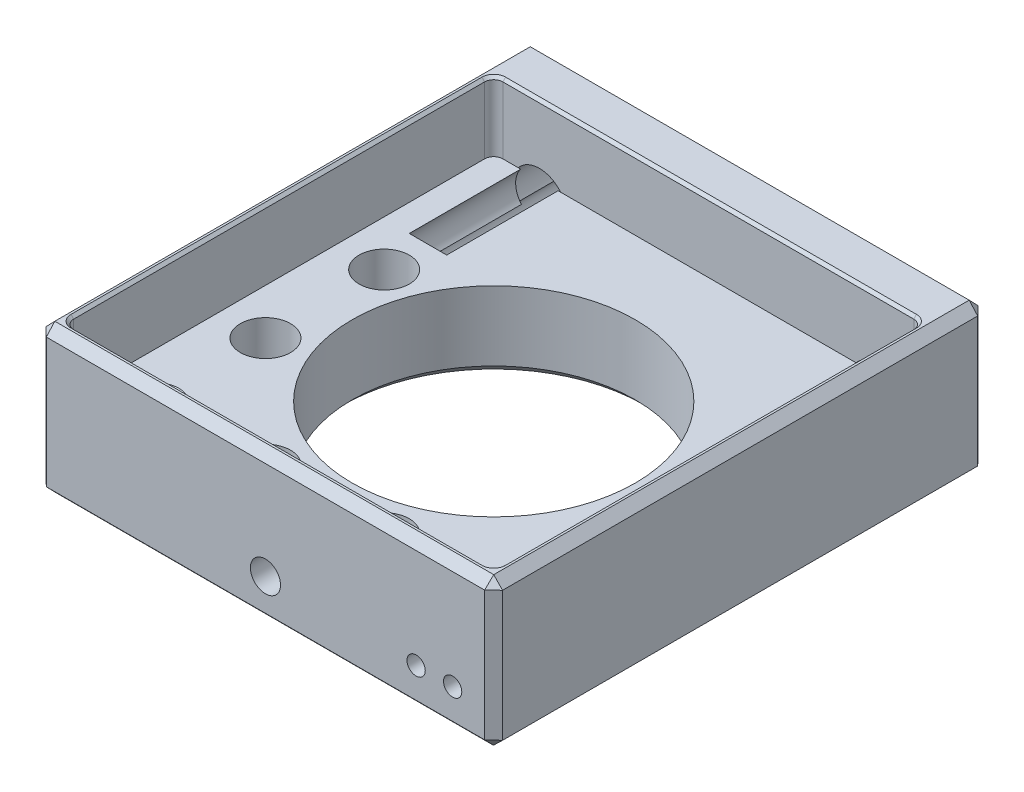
SolidWorks part; units mm, degrees
ref_plane "前视基准面" through (0, 0, 0) normal (0, 0, 1) x (1, 0, 0)
ref_plane "上视基准面" through (0, 0, 0) normal (0, 1, 0) x (1, 0, 0)
ref_plane "右视基准面" through (0, 0, 0) normal (1, 0, 0) x (0, 0, -1)
other "Configuration Table"
sketch "草图1" plane through (0, 0, 0) normal (0, 1, 0) x (1, 0, 0)
  line L1 (-25, 27) -> (25, 27)
  line L2 (-25, 27) -> (-25, -27)
  line L3 (-25, -27) -> (25, -27)
  line L4 (25, 27) -> (25, -27)
  line L5 (-25, 27) -> (25, -27) construction
  line L6 (-25, -27) -> (25, 27) construction
  point P0 (0, 0)
  dimension "D1" = 50
  dimension "D2" = 54
extrude "凸台-拉伸1" add sketch "草图1" along normal blind 16.2
sketch "草图2" plane through (0, 16.2, 0) normal (0, 1, 0) x (1, 0, 0)
  line L0 (0, 27) -> (0, -29.013) construction
  line L1 (23.5, -25.5) -> (-23.5, -25.5)
  line L2 (23.5, -25.5) -> (23.5, 21.5)
  line L3 (23.5, 21.5) -> (-23.5, 21.5)
  line L4 (-23.5, -25.5) -> (-23.5, 21.5)
  line L5 (23.5, -25.5) -> (-23.5, 21.5) construction
  line L6 (23.5, 21.5) -> (-23.5, -25.5) construction
  line L7 (25, 27) -> (-25, 27) construction
  point P0 (0, -2)
  dimension "D1" = 47
  dimension "D2" = 47
  dimension "D3" = 5.5
extrude "切除-拉伸1" cut sketch "草图2" against normal blind 7.6
sketch "草图3" plane through (0, 8.6, 0) normal (0, 1, 0) x (1, 0, 0)
  line L0 (0, 0) -> (0, -26.514) construction
  line L1 (-25, -27) -> (25, -27) construction
  circle A0 centre (0, -2) radius 15.5
  dimension "D2" = 31
  dimension "D1" = 25
extrude "切除-拉伸2" cut sketch "草图3" against normal up to next
hole_wizard "Ø5.5 (5.5) 直径孔1" positions "草图4" profile "草图5" hole size "Ø5.5" standard "GB"
sketch "草图4" plane through (0, 8.6, 0) normal (0, 1, 0) x (1, 0, 0)
  line L0 (-25, 27) -> (-25, -27) construction
  line L10 (-23.5, -27) -> (23.5, -27) construction
  line L11 (-25, -27) -> (25, -27) construction
  point P0 (-18.5, 4.5)
  point P2 (-18.5, -8.5)
  point P4 (-6.5, -20.5)
  point P26 (6.5, -20.5)
  dimension "D7" = 13
  dimension "D1" = 6.5
  dimension "D2" = 6.5
  dimension "D3" = 18.5
  dimension "D4" = 13
  dimension "D5" = 6.5
  dimension "D6" = 18.5
sketch "草图5" plane through (-18.5, 8.6, -4.5) normal (1, 0, 0) x (0, 0, 1)
  line L0 (0, 0) -> (0, 8.6)
  line L1 (0, 8.6) -> (2.75, 8.6)
  line L2 (2.75, 8.6) -> (2.75, 0)
  line L5 (2.75, 0) -> (0, 0)
  line L11 (0, -6.35) -> (0, 107.95) construction
  dimension "通孔孔直径" = 5.5
  dimension "通孔孔深度" = 8.6
sketch "草图9" plane through (0, 0, 0) normal (0, -1, 0) x (1, 0, 0)
  line L0 (-18.5, 11.25) -> (-18.5, -7.25) construction
  line L3 (-9.25, 20.5) -> (9.25, 20.5) construction
  line L6 (-18.5, 12) -> (-18.5, -8) construction
  line L12 (-17.4, 12) -> (-17.4, -8)
  line L13 (-19.6, 12) -> (-19.6, -8)
  line L14 (-10, 20.5) -> (10, 20.5) construction
  line L15 (-10, 21.6) -> (10, 21.6)
  line L16 (-10, 19.4) -> (10, 19.4)
  circle A20 centre (-18.5, 8.5) radius 2.75 construction
  circle A21 centre (-18.5, -4.5) radius 2.75 construction
  circle A22 centre (-6.5, 20.5) radius 2.75 construction
  circle A23 centre (6.5, 20.5) radius 2.75 construction
  arc A24 (-17.4, 12) -> (-19.6, 12) centre (-18.5, 12) ccw
  arc A25 (-19.6, -8) -> (-17.4, -8) centre (-18.5, -8) ccw
  arc A26 (-10, 21.6) -> (-10, 19.4) centre (-10, 20.5) ccw
  arc A27 (10, 19.4) -> (10, 21.6) centre (10, 20.5) ccw
  point P14 (-18.5, 2)
  point P19 (0, 20.5)
  dimension "D1" = 20
  dimension "D2" = 2.2
  dimension "D3" = 20
  dimension "D4" = 2.2
extrude "切除-拉伸4" cut sketch "草图9" against normal blind 2.6
hole_wizard "M4 螺纹孔1" positions "草图10" profile "草图11" tap size "M4" standard "GB"
sketch "草图10" plane through (-25, 0, 0) normal (-1, 0, 0) x (0, 0, 1)
  line L0 (-27, 0) -> (27, 0) construction
  line L1 (27, 16.2) -> (27, 0) construction
  point P0 (0, 4.5)
  dimension "D1" = 4.5
  dimension "D2" = 27
sketch "草图11" plane through (-25, 4.5, 0) normal (0, 1, 0) x (0, 0, 1)
  line L0 (0, 0) -> (0, 7.9914)
  line L1 (0, 7.9914) -> (1.65, 7)
  line L2 (1.65, 7) -> (1.65, 0)
  line L5 (1.65, 0) -> (0, 0)
  line L10 (0, 7.9914) -> (-1.65, 7) construction
  line L11 (0, -6.35) -> (0, 107.95) construction
  dimension "螺纹孔钻头直径" = 3.3
  dimension "螺纹孔钻头深度" = 7
  dimension "导头角度" = 118
hole_wizard "M4 螺纹孔2" positions "草图12" profile "草图13" tap size "M4" standard "GB"
sketch "草图12" plane through (0, 0, 27) normal (0, 0, 1) x (1, 0, 0)
  line L0 (-25, 0) -> (25, 0) construction
  line L1 (-25, 16.2) -> (-25, 0) construction
  point P0 (0, 4.5)
  dimension "D1" = 4.5
  dimension "D2" = 25
sketch "草图13" plane through (0, 4.5, 27) normal (1, 0, 0) x (0, -1, 0)
  line L0 (0, 0) -> (0, 7.9914)
  line L1 (0, 7.9914) -> (1.65, 7)
  line L2 (1.65, 7) -> (1.65, 0)
  line L5 (1.65, 0) -> (0, 0)
  line L10 (0, 7.9914) -> (-1.65, 7) construction
  line L11 (0, -6.35) -> (0, 107.95) construction
  dimension "螺纹孔钻头直径" = 3.3
  dimension "螺纹孔钻头深度" = 7
  dimension "导头角度" = 118
hole_wizard "Ø6.0mm 暗销孔1" positions "草图20" profile "草图21" hole size "Ø6.0" standard "GB"
sketch "草图20" plane through (0, 0, -27) normal (0, 0, -1) x (-1, 0, 0)
  line L0 (25, 16.2) -> (25, 0) construction
  line L1 (-25, 0) -> (25, 0) construction
  line L2 (-25, 16.2) -> (-25, 0) construction
  point P0 (18.5, 6.7)
  point P8 (-18.5, 6.7)
  dimension "D1" = 6.5
  dimension "D2" = 6.7
  dimension "D3" = 6.5
  dimension "D4" = 6.7
sketch "草图21" plane through (-18.5, 6.7, -27) normal (1, 0, 0) x (0, 1, 0)
  line L0 (0, 0) -> (0, 7.3026)
  line L1 (0, 7.3026) -> (3, 5.5)
  line L2 (3, 5.5) -> (3, 0)
  line L5 (3, 0) -> (0, 0)
  line L10 (0, 7.3026) -> (-3, 5.5) construction
  line L11 (0, -6.35) -> (0, 107.95) construction
  dimension "孔直径" = 6
  dimension "孔深度" = 5.5
  dimension "导头角度" = 118
sketch "草图25" plane through (0, 0, 27) normal (0, 0, 1) x (1, 0, 0)
  line L0 (18.5, 16.2) -> (18.5, 6.7) construction
  line L1 (-25, 16.2) -> (25, 16.2) construction
  line L3 (-25, 0) -> (25, 0) construction
  circle A0 centre (16.5, 4.3) radius 1
  circle A1 centre (20.5, 4.3) radius 1
  dimension "D2" = 4.3
  dimension "D3" = 2
  dimension "D4" = 4
extrude "切除-拉伸10" cut sketch "草图25" against normal blind 14
chamfer "倒角1" distance 1 angle 45 1 edges at (0, 0, 17.5)
ref_plane "基准面1" through (0, 0, 20.5) normal (0, 0, 1) x (1, 0, 0)
sketch "草图26" plane through (0, 0, 20.5) normal (0, 0, 1) x (1, 0, 0)
  line L0 (-18.5, 8.6) -> (-18.5, 6.1)
  line L1 (-18.5, 6.1) -> (-16, 8.6)
  line L2 (-16, 8.6) -> (-18.5, 8.6)
  line L3 (-25, 16.2) -> (25, 16.2) construction
  line L7 (-25, 16.2) -> (-25, 0) construction
  dimension "D1" = 7.6
  dimension "D2" = 6.5
  dimension "D3" = 2.5
  dimension "D4" = 2.5
revolve "切除-旋转1" cut sketch "草图26" angle 360 about L0
hole_wizard "Ø5.2 (5.2) 直径孔1" positions "草图27" profile "草图28" hole size "Ø5.2" standard "GB"
sketch "草图27" plane through (0, 0, -27) normal (0, 0, -1) x (-1, 0, 0)
  line L0 (-18.5, 6.7) -> (-18.5, 7) construction
  point P0 (-18.5, 7)
  dimension "D1" = 0.3
sketch "草图28" plane through (18.5, 7, -27) normal (1, 0, 0) x (0, 1, 0)
  line L0 (0, 0) -> (0, 49.5)
  line L1 (0, 49.5) -> (2.6, 49.5)
  line L2 (2.6, 49.5) -> (2.6, 0)
  line L5 (2.6, 0) -> (0, 0)
  line L10 (0, 49.5) -> (-2.6, 49.5) construction
  line L11 (0, -6.35) -> (0, 107.95) construction
  dimension "孔直径" = 5.2
  dimension "孔深度" = 49.5
  dimension "导头角度" = 180
hole_wizard "Ø5.2 (5.2) 直径孔2" positions "草图29" profile "草图30" hole size "Ø5.2" standard "GB"
sketch "草图29" plane through (0, 0, -27) normal (0, 0, -1) x (-1, 0, 0)
  line L0 (18.5, 6.7) -> (18.5, 7) construction
  point P0 (18.5, 7)
  dimension "D1" = 0.3
sketch "草图30" plane through (-18.5, 7, -27) normal (1, 0, 0) x (0, 1, 0)
  line L0 (0, 0) -> (0, 17.7)
  line L1 (0, 17.7) -> (2.6, 17.7)
  line L2 (2.6, 17.7) -> (2.6, 0)
  line L5 (2.6, 0) -> (0, 0)
  line L10 (0, 17.7) -> (-2.6, 17.7) construction
  line L11 (0, -6.35) -> (0, 107.95) construction
  dimension "孔直径" = 5.2
  dimension "孔深度" = 17.7
  dimension "导头角度" = 180
sketch "草图24" plane through (0, 0, -27) normal (0, 0, -1) x (-1, 0, 0)
  line L0 (18.5, 9.7) -> (18.5, 3.7) construction
  line L1 (0, 16.2) -> (0, 0) construction
  line L2 (-25, 16.2) -> (25, 16.2) construction
  line L3 (-25, 0) -> (25, 0) construction
  circle A0 centre (16.5, 4.3) radius 1
  circle A1 centre (20.5, 4.3) radius 1
  circle A4 centre (18.5, 6.7) radius 3 construction
  arc A5 (16.1784, 8.6) -> (20.8216, 8.6) centre (18.5, 6.7) ccw construction
  dimension "D2" = 2
  dimension "D3" = 4
  dimension "D4" = 4.3
extrude "切除-拉伸9" cut sketch "草图24" against normal blind 18.5
fillet "圆角1" radius 1 4 edges at (23.5, 12.4, -21.5) (23.5, 12.4, 25.5) (-23.5, 12.4, -21.5) (-23.5, 12.4, 25.5)
chamfer "倒角4" distance 1 angle 44 12 edges at (-25, 8.1, -27) (-25, 16.2, 0) (-25, 8.1, 27) (-25, 0, 0) (25, 8.1, 27) (0, 0, 27) (25, 0, 0) (0, 0, -27) (25, 8.1, -27) (0, 16.2, -27) (25, 16.2, 0) (0, 16.2, 27)
sketch "草图31" plane through (25, 0, 0) normal (1, 0, 0) x (0, 0, -1)
  line L0 (13.214, 70.2713) -> (126.5473, 70.2713) construction
  line L1 (-13.2356, 10.6942) -> (-14.7741, 6.8252)
  line L2 (-14.7741, 6.8252) -> (-12.8057, 6.8252)
  line L3 (-12.8057, 6.8252) -> (-12.3079, 7.832)
  line L4 (-12.3079, 7.832) -> (-13.1111, 7.832)
  line L5 (-13.1111, 7.832) -> (-11.8554, 10.6942)
  line L6 (-11.8554, 10.6942) -> (-13.2356, 10.6942)
  line L7 (-12.0251, 7.832) -> (-13.4166, 4.6531)
  line L8 (-13.4166, 4.6531) -> (-12.1269, 4.6531)
  line L9 (-12.1269, 4.6531) -> (-10.9099, 7.4335)
  line L10 (-27.8161, 6.8252) -> (23.3042, 6.8252) construction
  arc A0 (-11.0296, 9.5176) -> (-5.7352, 9.5176) centre (-8.3824, 4.4088) cw
  arc A1 (-11.0296, 9.5176) -> (-5.7352, 9.5176) centre (-8.3824, 17.235) ccw
  arc A2 (-12.0251, 7.832) -> (-4.7849, 7.832) centre (-8.405, -0.4096) cw
  arc A3 (-10.9099, 7.4335) -> (-4.7849, 7.832) centre (-8.405, 16.2038) ccw
  arc A4 (-11.0296, 6.0106) -> (-5.7352, 6.0785) centre (-8.3229, 1.4034) cw
  arc A5 (-11.0296, 6.0106) -> (-5.7352, 6.0785) centre (-8.4582, 11.9555) ccw
  text T0 "               Lier-opto" font "华文新魏" height 3.5
thread "螺纹线1" pitch 1 start angle 0, offset 0, length 0, pitch 1, diameter 6
ref_plane "基准面2" through (-15.5, 6.7, -27) normal (0, -1, 0) x (1, 0, 0)
sketch "螺纹线轮廓1" plane through (-15.5, 6.7, -27) normal (0, -1, 0) x (1, 0, 0)
  line L0 (0, 0) -> (0, 1) construction
  line L11 (0, 0) -> (0, 0.875)
  line L12 (0, 0.875) -> (-0.5413, 0.5625)
  line L13 (-0.5413, 0.5625) -> (-0.5413, 0.3125)
  line L15 (-0.5413, 0.3125) -> (0, 0)
  line L17 (-0.5413, 0.4375) -> (0, 0.4375) construction
  point P2 (0, 0)
  dimension "Pitch" = 1
  dimension "Profile_Angle" = 60
  dimension "Profile_Land" = 0.25
  dimension "Profile_Height" = 0.5413
sketch "草图35" plane through (0, 0, -8.5) normal (0, 0, -1) x (-1, 0, 0)
  circle A0 centre (16.5, 4.3) radius 1
  circle A1 centre (20.5, 4.3) radius 1
  dimension "D1" = 2
extrude "切除-拉伸11" [suppressed] cut sketch "草图35" against normal blind 10
thread "螺纹线2" pitch 1 start angle 0, offset 0, length 0, pitch 1, diameter 6
ref_plane "基准面3" through (21.5, 6.7, -27) normal (0, -1, 0) x (1, 0, 0)
sketch "螺纹线轮廓2" plane through (21.5, 6.7, -27) normal (0, -1, 0) x (1, 0, 0)
  line L0 (0, 0) -> (0, 1) construction
  line L11 (0, 0) -> (0, 0.875)
  line L12 (0, 0.875) -> (-0.5413, 0.5625)
  line L13 (-0.5413, 0.5625) -> (-0.5413, 0.3125)
  line L15 (-0.5413, 0.3125) -> (0, 0)
  line L17 (-0.5413, 0.4375) -> (0, 0.4375) construction
  point P2 (0, 0)
  dimension "Pitch" = 1
  dimension "Profile_Angle" = 60
  dimension "Profile_Land" = 0.25
  dimension "Profile_Height" = 0.5413
chamfer "倒角5" distance 0.3 angle 45 37 edges at (-9.5102, 0, 21.6) (-11.1, 0, 20.5) (-9.5102, 0, 19.4) (-6.5, 0, 17.75) (0, 0, 19.4) (6.5, 0, 17.75) (9.5102, 0, 19.4) (11.1, 0, 20.5) (9.5102, 0, 21.6) (6.5, 0, 23.25) (0, 0, 21.6) (-6.5, 0, 23.25) (-17.4, 0, 11.5102) (-18.5, 0, 13.1) (-19.6, 0, 11.5102) (-21.25, 0, 8.5) (-19.6, 0, 2) (-21.25, 0, -4.5) (-19.6, 0, -7.5102) (-18.5, 0, -9.1) (-17.4, 0, -7.5102) (-15.75, 0, -4.5) (-17.4, 0, 2) (-15.75, 0, 8.5) (0, 16.2, 25.5) (23.2071, 16.2, 25.2071) (-23.2071, 16.2, 25.2071) (23.5, 16.2, 2) (-23.5, 16.2, 2) (23.2071, 16.2, -21.2071) (-23.2071, 16.2, -21.2071) (0, 16.2, -21.5) (15.5, 6.7, -27) (-18.5, 3.7, -27) (-18.5, 9.7, -27) (-15.8598, 3.5318, -27) (-21.1402, 3.5318, -27)
wrap "包覆1" [suppressed] sketch "草图31" source sketch "草图31" thickness 1 parameters "D1"=1
